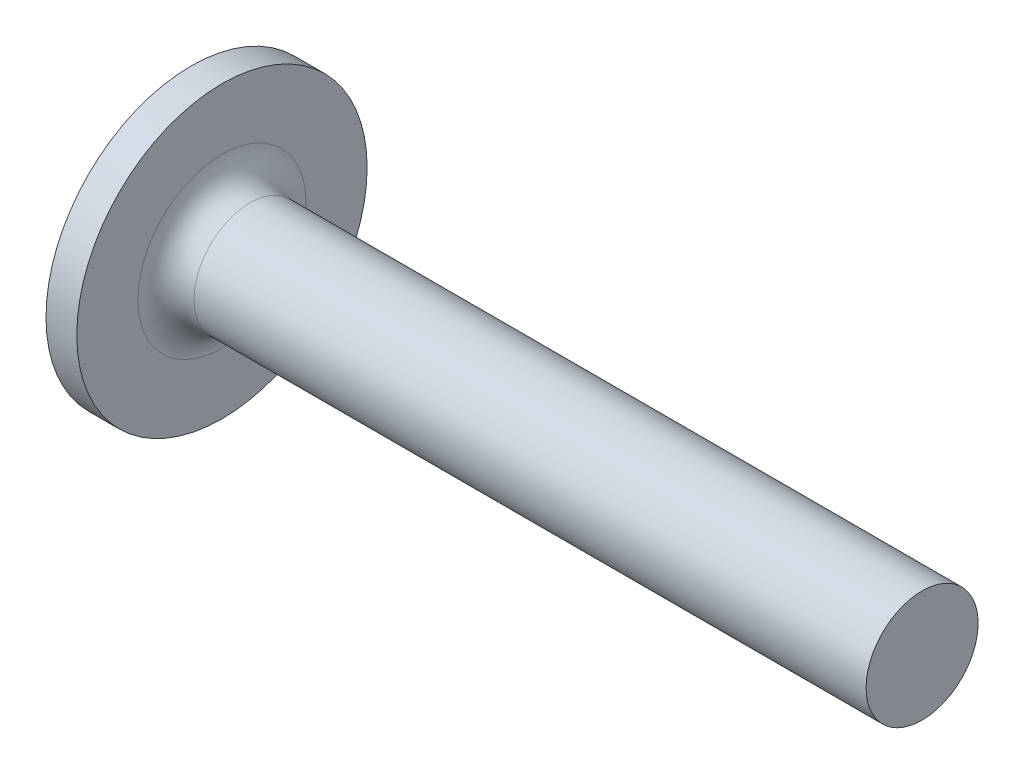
SolidWorks part; units mm, degrees
revolve "Base-Revolve" add sketch "BodySke"
sketch "BodySke" plane through (0, 0, 0) normal (0, 0, 1) x (1, 0, 0)
  line L1 (5.9, 4) -> (5.9, 10.3662)
  line L2 (5.9, 4) -> (55.9, 4)
  line L3 (55.9, 4) -> (55.9, 0)
  line L4 (55.9, 0) -> (3.7, 0)
  line L5 (-6.35, 0) -> (82.55, 0) construction
  line L8 (5.9, 10.3662) -> (3.7, 10.3662)
  line L10 (7.15, 5.5875) -> (7.15, -3.9375) construction
  line L11 (17.9, 6.35) -> (17.9, -3.175) construction
  line L12 (3.7, 10.3662) -> (3.7, 0)
revolve "ThreadSchematic" cut sketch "ThdSchSke"
sketch "ThdSchSke" plane through (0, 0, 0) normal (0, 0, 1) x (1, 0, 0)
  line L0 (17.9, -3.3095) -> (17.4165, -4)
  line L1 (17.9, -3.3095) -> (18.3835, -4)
  line L2 (18.3835, -4) -> (18.3835, -5)
  line L3 (-3.175, 0) -> (5.1513, 0) construction
  line L4 (5.9, -10.3662) -> (5.9, 10.3662) construction
  line L5 (18.3835, -5) -> (17.4165, -5)
  line L6 (17.4165, -5) -> (17.4165, -4)
  dimension "D1" = 360
fillet "Fillet1" radius 2 1 edges at (5.9, 0, 4)
ref_plane "Plane1" through (0, 0, 0) normal (0, 0, 1) x (1, 0, 0)
ref_plane "Plane2" through (0, 0, 0) normal (0, 1, 0) x (1, 0, 0)
ref_plane "Plane3" through (0, 0, 0) normal (1, 0, 0) x (0, 0, -1)
other "Configuration Table"
sketch "Sketch3" plane through (0, 0, 0) normal (1, 0, 0) x (0, 0, -1)
  line L0 (-1.08, 4.4) -> (1.08, 4.4)
  line L1 (1.08, 4.4) -> (1.08, -4.4)
  line L2 (1.08, -4.4) -> (-1.08, -4.4)
  line L3 (-1.08, -4.4) -> (-1.08, 4.4)
ref_plane "Plane4" through (4.6, 0, 0) normal (1, 0, 0) x (0, 0, -1)
sketch "PanSke" plane through (0, 0, 0) normal (0, 0, 1) x (1, 0, 0)
  line L0 (0, 0) -> (15.875, 0) construction
  line L1 (-6.35, 0) -> (82.55, 0) construction
  line L2 (3.7, 10.3662) -> (3.7, -10.3662) construction
  line L4 (3.7, 8.2286) -> (3.7, 0)
  line L5 (0, 0) -> (3.7, 0)
  arc A0 (0, 0) -> (3.7, 8.2286) centre (11, 0) cw
  dimension "RADf" = 11
revolve "Pan" add sketch "PanSke" angle 360 about L0
sketch "Sketch4" plane through (4.6, 0, 0) normal (1, 0, 0) x (0, 0, -1)
  line L0 (-1.08, 2.1065) -> (1.08, 2.1065)
  line L3 (1.08, 2.1065) -> (1.08, -2.1065)
  line L4 (1.08, -2.1065) -> (-1.08, -2.1065)
  line L5 (-1.08, -2.1065) -> (-1.08, 2.1065)
loft "Recess" cut profiles "Sketch3", "Sketch4"
pattern_circular "RecPat" count 2 every 90 about axis through (0, 0, 0) along (1, 0, 0) of "Recess"
sketch "RecCorSke" plane through (0, 0, 0) normal (0, 0, 1) x (1, 0, 0)
  line L0 (-3.175, 0) -> (15.875, 0) construction
  line L2 (0, 0) -> (0, 2.2522)
  line L3 (0, 2.2522) -> (4.6, 1.9305)
  line L4 (4.6, 1.9305) -> (5.2273, 0)
  line L5 (5.2273, 0) -> (0, 0)
  dimension "Diameter" = 3.861
  dimension "Depth" = 4.6
  dimension "Draft_angle" = 4
  dimension "Bottom_angle" = 18
revolve "RecessCore" cut sketch "RecCorSke" angle 360 about L0
pattern_linear "ThdSchPat" [suppressed]
equation "\"D1@Sketch3\" = \"Cross_dia@Sketch3\" / 2"
equation "\"D2@Sketch3\" = \"Cross_width@Sketch3\" / 2"
equation "\"D1@Sketch4\" = \"Cross_width@Sketch3\""
equation "\"D3@Sketch4\" = \"D1@Sketch4\" / 2"
equation "\"D4@Sketch4\" = \"D2@Sketch4\" / 2"
equation "\"Thread_length@ThreadCosmetic\" = ((sgn( (\"Length@BodySke\" - \"Advance@BodySke\" * 2.0 ) - \"Thread_nom@BodySke\" )-1)*( (\"Length@BodySke\" - \"Advance@BodySke\" * 2.0 ) - \"Thread_nom@BodySke\" ))/-2+ \"Thread_"
equation "\"Thread_minor@ThdSchSke\" = \"Thread_minor@ThreadCosmetic\""
equation "\"Diameter@ThdSchSke\" = \"Diameter@BodySke\""
equation "\"Overcut@ThdSchSke\" = \"Diameter@BodySke\" * 1.25"
equation "\"Start@ThdSchSke\" =  \"Length@BodySke\" -  \"Thread_length@ThreadCosmetic\"  '---Non-countersunk---"
equation "\"Num_threads@ThdSchPat\" = int( \"Thread_length@ThreadCosmetic\" / \"Advance@BodySke\" + 0.999 )  + 1"
equation "\"Advance@ThdSchPat\" = \"Thread_length@ThreadCosmetic\" /  (\"Num_threads@ThdSchPat\" - 1) 'relax it"
